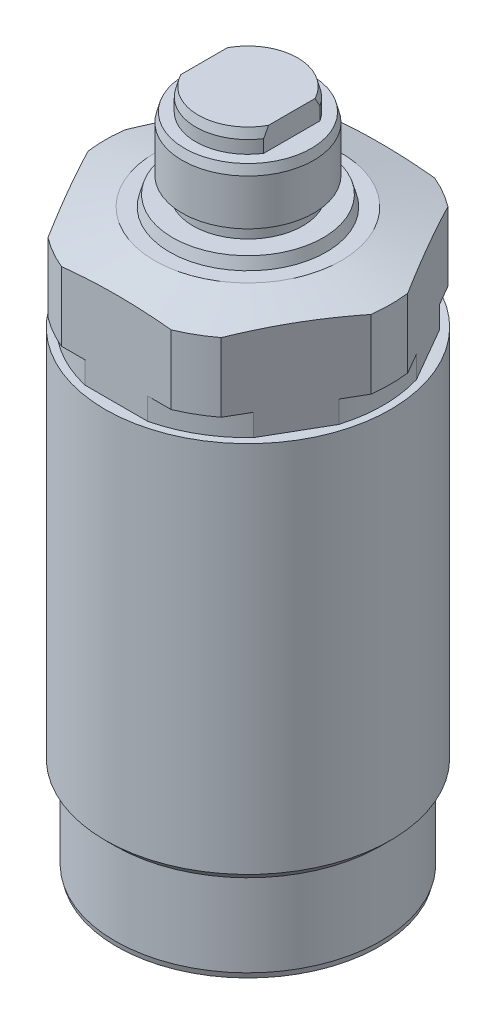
SolidWorks part; units mm, degrees
ref_plane "Front Plane" through (0, 0, 0) normal (0, 0, 1) x (1, 0, 0)
ref_plane "Top Plane" through (0, 0, 0) normal (0, 1, 0) x (1, 0, 0)
ref_plane "Right Plane" through (0, 0, 0) normal (1, 0, 0) x (0, 0, -1)
sketch "Sketch1" plane through (0, 0, 0) normal (0, 0, 1) x (1, 0, 0)
  line L0 (13051.697, 11009.2616) -> (13051.697, 11010.3616)
  line L1 (13052.1469, 11070.3283) -> (13052.3702, 11071.1616)
  line L2 (13043.8969, 11054.165) -> (13044.5636, 11054.165)
  line L3 (13044.7969, 11009.7616) -> (13044.9309, 11009.2616)
  line L4 (13051.1202, 11069.165) -> (13052.1469, 11069.165)
  line L5 (13044.7969, 11017.265) -> (13044.7969, 11009.7616)
  line L6 (13050.8969, 11064.165) -> (13051.8969, 11064.165)
  line L7 (13051.697, 11010.3616) -> (13055.8969, 11010.3616)
  line L8 (13055.8969, 11011.2583) -> (13056.8969, 11011.2583)
  line L9 (13055.8969, 11010.3616) -> (13055.8969, 11011.2583)
  line L10 (13056.8969, 11011.2583) -> (13056.8969, 11071.1616)
  line L11 (13044.9309, 11009.2616) -> (13051.697, 11009.2616)
  line L12 (13052.3702, 11071.1616) -> (13056.8969, 11071.1616)
  line L14 (13043.8969, 11060.4559) -> (13043.8969, 11054.165)
  line L15 (13044.5636, 11054.165) -> (13044.5636, 11052.165)
  line L16 (13043.8969, 11052.165) -> (13044.5636, 11052.165)
  line L18 (13048.3969, 11061.6616) -> (13043.8969, 11060.4559)
  line L20 (13050.0369, 11062.655) -> (13051.8969, 11062.655)
  line L21 (13050.0369, 11062.655) -> (13049.7553, 11061.6616)
  line L22 (13052.1469, 11070.3283) -> (13052.1469, 11069.165)
  line L29 (13044.7969, 11017.265) -> (13043.8969, 11018.165)
  line L34 (13043.8969, 11052.165) -> (13043.8969, 11018.165)
  line L71 (13050.8969, 11068.3316) -> (13051.1202, 11069.165)
  line L73 (13050.8969, 11068.3316) -> (13050.8969, 11064.165)
  line L76 (13051.8969, 11064.165) -> (13051.8969, 11062.655)
  line L77 (13056.8969, 11084.6484) -> (13056.8969, 11002.4177) construction
  line L82 (13049.7553, 11061.6616) -> (13048.3969, 11061.6616)
  dimension "D1" = 34
  dimension "D2" = 2
  dimension "D3" = 5
  dimension "D4" = 9.5
  dimension "D5" = 61.9
revolve "Revolve1" add sketch "Sketch1" angle 360 about L77
sketch "Sketch2" plane through (0, 11061.6616, 0) normal (0, 1, 0) x (1, 0, 0)
  line L1 (13070.7533, 0) -> (13063.8251, 12)
  line L2 (13063.8251, 12) -> (13049.9687, 12)
  line L3 (13049.9687, 12) -> (13043.0405, 0)
  line L4 (13043.0405, 0) -> (13049.9687, -12)
  line L5 (13049.9687, -12) -> (13063.8251, -12)
  line L6 (13063.8251, -12) -> (13070.7533, 0)
  circle A0 centre (13056.8969, 0) radius 12 construction
extrude "Extrude2" cut sketch "Sketch2" along a picked direction on the side against the normal up to surface (9.4967 mm away) flip side to cut
sketch "Sketch3" plane through (0, 11071.1616, 0) normal (0, 1, 0) x (1, 0, 0)
  line L0 (13060.8969, 7.8519) -> (13060.8969, -8.7465)
  line L1 (13060.8969, -8.7465) -> (13068.4237, -0.9252)
  line L2 (13068.4237, -0.9252) -> (13060.8969, 7.8519)
  line L3 (13052.8969, -8.7465) -> (13052.8969, 7.5)
  line L4 (13052.8969, 7.5) -> (13044.5017, 0.3008)
  line L5 (13044.5017, 0.3008) -> (13052.8969, -8.7465)
  circle A0 centre (13056.8969, 0) radius 8.5 construction
  circle A1 centre (13056.8969, 0) radius 4.5267 construction
  dimension "D1" = 4
  dimension "D2" = 4
extrude "Extrude3" cut sketch "Sketch3" against normal up to surface (1.9967 mm away)
